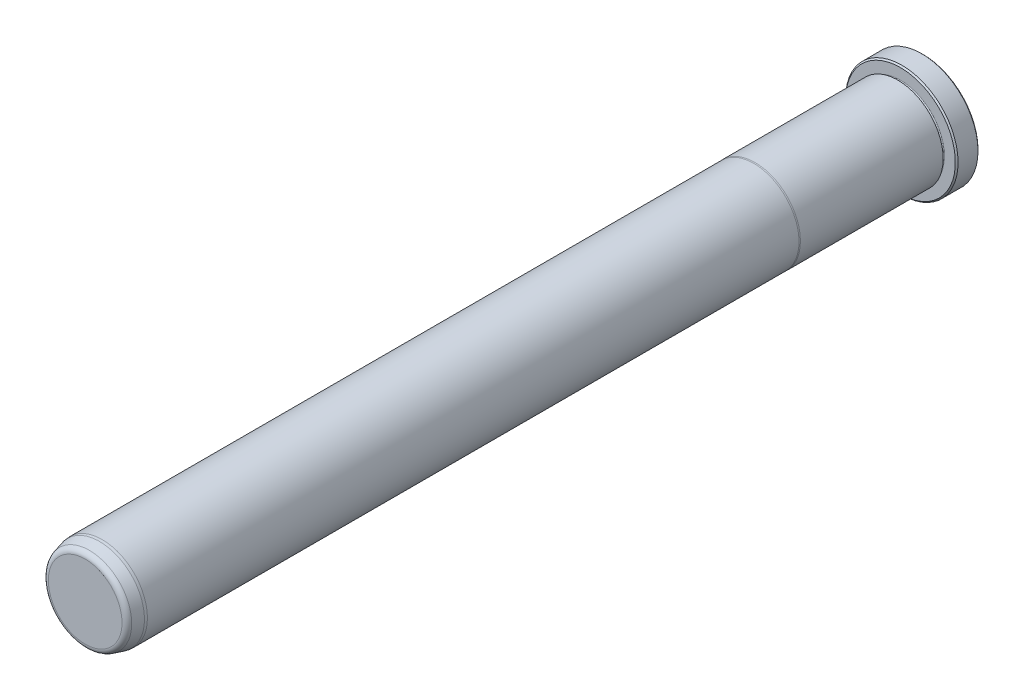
SolidWorks part; units mm, degrees
ref_plane "Front Plane" through (0, 0, 0) normal (0, 0, 1) x (1, 0, 0)
ref_plane "Top Plane" through (0, 0, 0) normal (0, 1, 0) x (1, 0, 0)
ref_plane "Right Plane" through (0, 0, 0) normal (1, 0, 0) x (0, 0, -1)
sketch "Sketch1" plane through (0, 0, 0) normal (1, 0, 0) x (0, 0, -1)
  line L0 (0, 0) -> (0, 15.748)
  line L1 (0, 15.748) -> (-6.35, 15.748)
  line L2 (-6.35, 15.748) -> (-6.35, 12.3063)
  line L3 (-6.35, 11.9253) -> (-7.112, 11.9253) construction
  line L4 (-7.112, 12.3063) -> (-7.112, 12.7127)
  line L5 (-7.112, 12.7127) -> (-47.1348, 12.7127)
  line L6 (-47.1348, 12.7127) -> (-47.498, 12.6873)
  line L7 (-47.498, 12.6873) -> (-230.1875, 12.6873)
  line L9 (-234.95, 11.5487) -> (-234.95, 0)
  line L10 (-234.95, 0) -> (0, 0)
  line L11 (0, 0) -> (13.6287, 0) construction
  line L12 (-230.1875, 12.6873) -> (-230.9495, 12.6206)
  line L13 (-230.9495, 12.6206) -> (-234.95, 11.5487)
  arc A0 (-7.112, 12.3063) -> (-6.35, 12.3063) centre (-6.731, 12.3063) ccw
  dimension "D14" = 0.762
  dimension "D1" = 6.35
  dimension "D2" = 0.762
  dimension "D3" = 31.496
  dimension "D4" = 25.4254
  dimension "D5" = 47.498
  dimension "D6" = 234.95
  dimension "D7" = 0.7874
  dimension "D8" = 4
  dimension "D9" = 25.3746
  dimension "D10" = 5
  dimension "D11" = 15
  dimension "D12" = 0.762
  dimension "D13" = 4.7625
revolve "Revolve1" add sketch "Sketch1" angle 360 about L11
fillet "Fillet6" radius 1.5875 1 edges at (11.5487, 0, 234.95)
chamfer "Chamfer1" distance 0.381 angle 45 2 edges at (15.748, 0, 0) (15.748, 0, 6.35)
